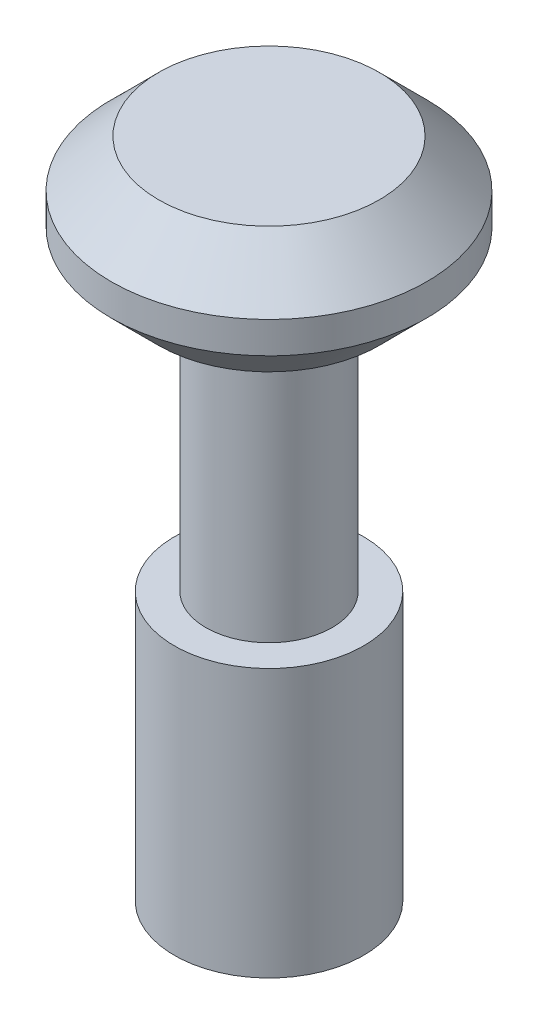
SolidWorks part; units mm, degrees
ref_plane "Ebene vorne" through (0, 0, 0) normal (0, 0, 1) x (1, 0, 0)
ref_plane "Ebene oben" through (0, 0, 0) normal (0, 1, 0) x (1, 0, 0)
ref_plane "Ebene rechts" through (0, 0, 0) normal (1, 0, 0) x (0, 0, -1)
sketch "Skizze1" plane through (0, 0, 0) normal (0, 1, 0) x (1, 0, 0)
  circle A0 centre (0, 0) radius 5
  dimension "D1" = 10
extrude "Aufsatz-Linear austragen1" add sketch "Skizze1" along normal blind 4
chamfer "Fase1" distance 1.5 angle 45 2 edges at (0, 0, 5) (0, 4, 5)
sketch "Skizze2" plane through (0, 0, 0) normal (0, -1, 0) x (1, 0, 0)
  circle A0 centre (0, 0) radius 2
  dimension "D1" = 4
extrude "Aufsatz-Linear austragen2" add sketch "Skizze2" along normal blind 8.5
sketch "Skizze3" plane through (0, -8.5, 0) normal (0, -1, 0) x (1, 0, 0)
  circle A0 centre (0, 0) radius 3
  dimension "D1" = 6
extrude "Aufsatz-Linear austragen3" add sketch "Skizze3" along normal blind 8.5
hole_wizard "M3 Gewindebohrung1" positions "Skizze5" profile "Skizze6" tap size "M3" standard "Din"
sketch "Skizze5" plane through (0, -17, 0) normal (0, -1, 0) x (-1, 0, 0)
  point P0 (0, 0)
sketch "Skizze6" plane through (0, -17, 0) normal (1, 0, 0) x (0, 0, -1)
  line L0 (0, 0) -> (0, 5.7511)
  line L1 (0, 5.7511) -> (1.25, 5)
  line L2 (1.25, 5) -> (1.25, 0)
  line L5 (1.25, 0) -> (0, 0)
  line L10 (0, 5.7511) -> (-1.25, 5) construction
  line L11 (0, -6.35) -> (0, 107.95) construction
  dimension "Bohrerdurchmesser" = 2.5
  dimension "Bohrungstiefe" = 5
  dimension "Spitzenwinkel" = 118
